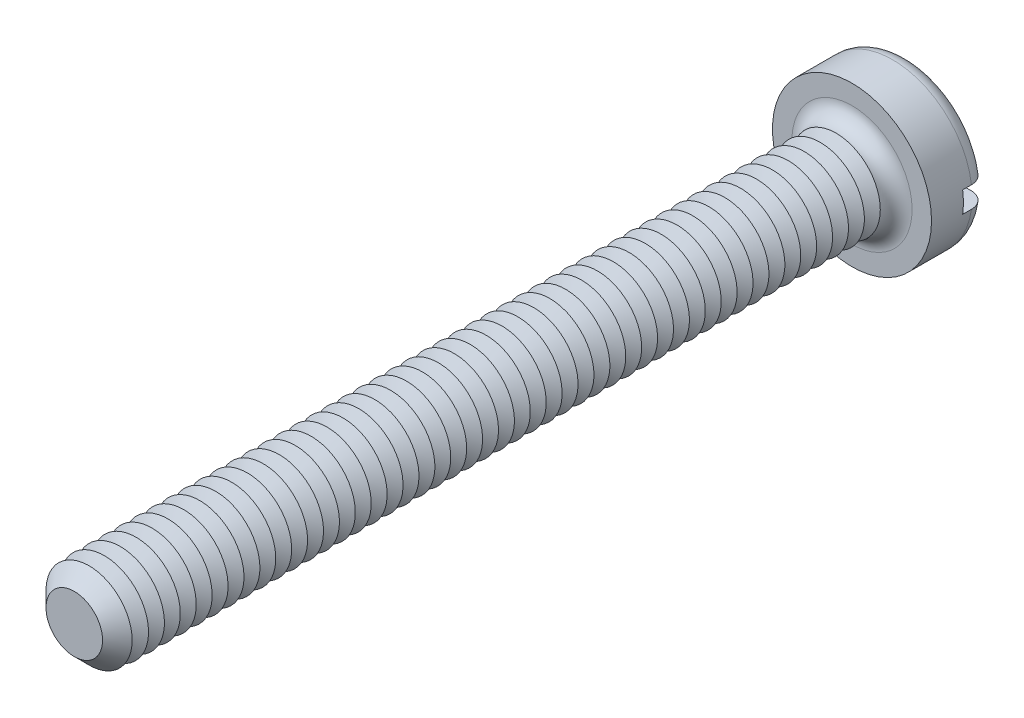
SolidWorks part; units mm, degrees
ref_plane "Front Plane" through (0, 0, 0) normal (0, 0, 1) x (1, 0, 0)
ref_plane "Top Plane" through (0, 0, 0) normal (0, 1, 0) x (1, 0, 0)
ref_plane "Right Plane" through (0, 0, 0) normal (1, 0, 0) x (0, 0, -1)
sketch "Sketch3" plane through (0, 0, 0) normal (0, 0, 1) x (1, 0, 0)
  circle A0 centre (0, 0) radius 2.25
  dimension "D1" = 4.5
extrude "Boss-Extrude2" add sketch "Sketch3" against normal blind 1.6
sketch "Sketch4" plane through (0, 0, 0) normal (0, 0, 1) x (1, 0, 0)
  circle A0 centre (0, 0) radius 1.25
  dimension "D1" = 2.5
extrude "Boss-Extrude3" add sketch "Sketch4" along normal blind 22
fillet "Fillet1" radius 0.45 2 edges at (2.25, 0, -1.6) (1.25, 0, 0)
chamfer "Chamfer1" distance 0.45 angle 45 1 edges at (1.25, 0, 22)
sketch "Sketch5" plane through (0, 0, 0) normal (1, 0, 0) x (0, 0, -1)
  line L0 (1.6944, 0) -> (-7.6738, 0) construction
sketch "Sketch6" plane through (0, 0, 0) normal (1, 0, 0) x (0, 0, -1)
  line L0 (-0.45, 1.25) -> (-0.675, 0.8603)
  line L1 (-0.675, 0.8603) -> (-0.9, 1.25)
  line L2 (-0.45, 1.25) -> (-21.55, 1.25) construction
  line L3 (-0.9, 1.25) -> (-0.45, 1.25)
  dimension "D1" = 0.45
revolve "Cut-Revolve1" cut sketch "Sketch6" angle 360 about L0
pattern_linear "LPattern1" count 47 spacing 0.45 along (0, 0, 1) of "Cut-Revolve1"
sketch "Sketch8" plane through (0, 0, -1.6) normal (0, 0, -1) x (-1, 0, 0)
  line L1 (2.25, -0.3) -> (-2.25, -0.3)
  line L2 (2.25, -0.3) -> (2.25, 0.3)
  line L3 (2.25, 0.3) -> (-2.25, 0.3)
  line L4 (-2.25, -0.3) -> (-2.25, 0.3)
  line L5 (2.25, -0.3) -> (-2.25, 0.3) construction
  line L6 (2.25, 0.3) -> (-2.25, -0.3) construction
  point P0 (0, 0)
  dimension "D1" = 4.5
  dimension "D2" = 0.6
extrude "Cut-Extrude1" cut sketch "Sketch8" against normal blind 0.7
